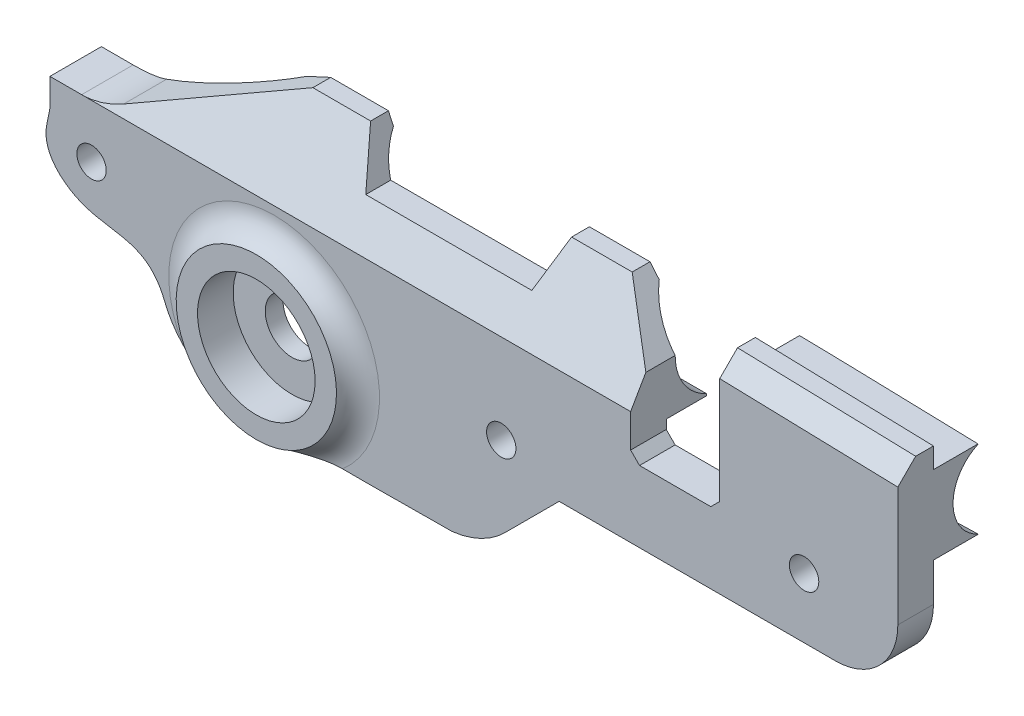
SolidWorks part; units mm, degrees
ref_plane "Спереди" through (0, 0, 0) normal (0, 0, 1) x (1, 0, 0)
ref_plane "Сверху" through (0, 0, 0) normal (0, 1, 0) x (1, 0, 0)
ref_plane "Справа" through (0, 0, 0) normal (1, 0, 0) x (0, 0, -1)
sketch "Эскиз1" plane through (0, 0, 0) normal (0, 0, 1) x (1, 0, 0)
  line L0 (35.5, -9.7) -> (35.5, 0)
  line L1 (35.5, 0) -> (88.5243, 0)
  line L2 (88.5243, 0) -> (88.5243, -5.9869)
  line L3 (59.5019, -24.7) -> (68.4981, -24.6346)
  line L14 (74.4981, -21.7) -> (80.4981, -15.7)
  line L15 (80.4981, -15.7) -> (111.5243, -15.7)
  line L16 (88.5243, -6.7) -> (88.5243, -5.9869)
  line L17 (88.5243, -5.9869) -> (68.4, -5.9869)
  line L18 (68.4, -5.9869) -> (68.4, -14.8)
  line L19 (68.4, -14.8) -> (69.2, -14.8)
  line L20 (69.2, -14.8) -> (69.1981, -17.1867)
  line L21 (69.1981, -17.1867) -> (68.4981, -17.1867)
  line L22 (68.4981, -17.1867) -> (68.4981, -18.1686)
  line L23 (68.4981, -24.3314) -> (68.4981, -24.6346)
  line L26 (74.4981, -21.7) -> (80.4981, -15.7)
  line L27 (80.4981, -15.7) -> (111.5243, -15.7)
  line L28 (88.5243, -6.7) -> (88.5243, -5.9869)
  line L37 (50.5, -9.7) -> (35.5, -9.7)
  line L42 (45.5, -24.7) -> (59.5019, -24.7)
  line L43 (59.5019, -24.7) -> (59.5019, -24.3314)
  line L44 (59.5019, -18.1686) -> (59.5019, -17.1867)
  line L45 (59.5019, -17.1867) -> (58.8019, -17.1867)
  line L46 (58.8019, -17.1867) -> (58.8, -14.8)
  line L47 (58.8, -14.8) -> (59.6, -14.8)
  line L48 (59.6, -14.8) -> (59.6, -10.8637)
  line L49 (59.6, -10.8637) -> (59.4757, -10.8637)
  line L55 (45.5, -24.7) -> (59.5019, -24.7)
  line L130 (118.5243, -8.7) -> (118.5243, -4.7994)
  line L314 (23.328, -6) -> (23.328, -5.8795)
  line L315 (23.328, -6) -> (23.328, -5.8795)
  line L338 (0, 0) -> (152, 0) construction
  line L371 (118.5243, -8.7) -> (118.5243, -4.7994)
  line L421 (97.5243, -7.7) -> (89.5243, -7.7)
  line L422 (97.5243, -7.7) -> (89.5243, -7.7)
  line L423 (89.5243, -7.7) -> (88.5243, -6.7)
  line L424 (89.5243, -7.7) -> (88.5243, -6.7)
  line L425 (118.5243, -4.7994) -> (98.5243, -5.3484)
  line L426 (118.5243, -4.7994) -> (98.5243, -5.3484)
  line L427 (98.5243, -5.3484) -> (98.5243, -6.7)
  line L428 (98.5243, -5.3484) -> (98.5243, -6.7)
  line L429 (98.5243, -6.7) -> (97.5243, -7.7)
  line L430 (98.5243, -6.7) -> (97.5243, -7.7)
  line L464 (31.5, -6.7) -> (31.5, -6)
  line L465 (31.5, -6.7) -> (31.5, -6)
  line L466 (31.5, -6) -> (23.328, -6)
  line L467 (31.5, -6) -> (23.328, -6)
  line L468 (35.5, -9.7) -> (34.5, -9.7)
  line L469 (35.5, -9.7) -> (34.5, -9.7)
  arc A3 (68.4981, -18.1686) -> (68.4981, -24.3314) centre (73.0313, -21.25) ccw
  arc A7 (59.5019, -24.3314) -> (59.5019, -18.1686) centre (54.9687, -21.25) ccw
  arc A53 (111.5243, -15.7) -> (118.5243, -8.7) centre (111.5243, -8.7) ccw
  arc A54 (111.5243, -15.7) -> (118.5243, -8.7) centre (111.5243, -8.7) ccw
  arc A60 (36.2067, -18.3926) -> (45.5, -24.7) centre (45.5, -14.7) ccw
  arc A61 (36.2067, -18.3926) -> (45.5, -24.7) centre (45.5, -14.7) ccw
  arc A70 (68.4981, -24.6346) -> (74.4981, -21.7) centre (67.3567, -14.7) ccw
  arc A71 (68.4981, -24.6346) -> (74.4981, -21.7) centre (67.3567, -14.7) ccw
  arc A72 (31.5, -6.7) -> (34.5, -9.7) centre (34.5, -6.7) ccw
  arc A73 (31.5, -6.7) -> (34.5, -9.7) centre (34.5, -6.7) ccw
  parabola Q1
  spline S1 degree 3 poles (-1530.0279, -1265.6146) (88.0841, 34.5224) (11.9448, -0.836) (45.9487, -32.1139) (86.3243, 81.025) (-456.3325, -1956.6163) knots -1.641607 -1.641607 -1.641607 -1.641607 0.136351 0.447574 3.918539 3.918539 3.918539 3.918539 only from (23.328, -5.8795) to (36.2067, -18.3926)
  spline S2 degree 3 poles (23.328, -5.8795) (23.328, -6.4695) (21.9843, -10.0707) (28.0999, -15.6961) (34.2809, -13.5457) (36.2067, -18.3926) knots 0 0 0 0 0.136351 0.447574 1 1 1 1
  dimension "D1" = 0
  dimension "D2" = 0
extrude "Бобышка-Вытянуть1" add sketch "Эскиз1" along normal blind 4
sketch "Эскиз2" plane through (0, 0, 0) normal (0, 0, -1) x (-1, 0, 0)
  line L1 (-50.5, -9.7) -> (-35.5, -9.7) construction
  line L2 (-50.5, -9.7) -> (-35.5, -9.7) construction
  line L7 (-59.4757, -10.8637) -> (-88.5243, -10.8637) construction
  line L8 (-88.5243, -6.7) -> (-88.5243, 0) construction
  line L9 (-88.5243, -10.8637) -> (-88.5243, 0) construction
  line L10 (-88.5243, 0) -> (-35.5, 0)
  line L12 (-35.5, 0) -> (-35.5, -9.7) construction
  line L13 (-59.5237, -10.5637) -> (-88.5243, -10.5637) construction
  line L14 (-50.4912, -9.4) -> (-35.5, -9.4)
  line L15 (-35.5, -9.4) -> (-35.5, 0)
  line L16 (-88.5243, -10.5637) -> (-88.5243, 0) construction
  line L17 (-59.5237, -10.5637) -> (-64, -10.5637)
  line L18 (-64, -10.5637) -> (-64, 0) construction
  line L19 (-64, -10.5637) -> (-64, -5.6869)
  line L20 (-64, -5.6869) -> (-88.5243, -5.6869)
  line L21 (-88.5243, -5.9869) -> (-68.4, -5.9869) construction
  line L22 (-88.5243, -5.6869) -> (-88.5243, 0)
  parabola Q4 construction
  parabola Q5 construction
  spline S0 degree 1 poles (-59.5237, -10.5637) (-50.4912, -9.4) knots 0 0 1 1 construction
  spline S1 degree 3 poles (-59.5237, -10.5637) (-58.798, -10.3262) (-57.3196, -9.9169) (-55.0793, -9.5203) (-52.8072, -9.3355) (-51.2592, -9.3553) (-50.4912, -9.4) knots 0.499721 0.499721 0.499721 0.499721 0.499884 0.500048 0.500211 0.500374 0.500374 0.500374 0.500374
  dimension "D2" = 0.3
  dimension "D1" = 0.3
extrude "Бобышка-Вытянуть2" add sketch "Эскиз2" along normal blind 3
sketch "Эскиз3" plane through (35.5, 0, 0) normal (-1, 0, 0) x (0, 0, 1)
  line L0 (-3, -9.4) -> (-4.8006, -9.4)
  line L1 (-3, -9.4) -> (-3, -6.5)
  line L2 (-3, -9.4) -> (-3, 0) construction
  line L3 (-3.25, -6.5) -> (-6.25, -6.5) construction
  arc A0 (-4.8006, -9.4) -> (-3, -6.5) centre (-6.1307, -6.5651) ccw
extrude "Бобышка-Вытянуть3" add sketch "Эскиз3" against normal blind 17 contours A0 L0 L1
sketch "Эскиз4" plane through (35.5, 0, 0) normal (-1, 0, 0) x (0, 0, 1)
  circle A0 centre (-7, 0) radius 6
  dimension "D1" = 12
extrude "Вырез-Вытянуть1" cut sketch "Эскиз4" against normal blind 57
sketch "Эскиз5" plane through (0, 0, 0) normal (0, 0, -1) x (-1, 0, 0)
  line L0 (-60, -24.6383) -> (-68, -24.6383)
  line L2 (-60, -24.6383) -> (-60, -5.6869)
  line L3 (-60, -5.6869) -> (-68, -5.6869)
  line L4 (-68, -24.6383) -> (-68, -5.6869)
  line L5 (-59.75, -25.5) -> (-59.75, -24.5) construction
  line L6 (-59.5019, -24.7) -> (-68.4981, -24.6346) construction
  line L7 (-88.5243, -5.6869) -> (-64, -5.6869) construction
  dimension "D1" = 8
  dimension "D2" = 0.25
extrude "Бобышка-Вытянуть4" add sketch "Эскиз5" along normal blind 5.5
sketch "Эскиз6" plane through (0, 0, -7) normal (0, 0, -1) x (-1, 0, 0)
  line L0 (-64, -25.6536) -> (-64, 0) construction
  line L2 (-68.4981, -24.6346) -> (-68.4981, -24.3314) construction
  line L3 (-68.4981, -18.1686) -> (-68.4981, -17.1867) construction
  line L4 (-69.1981, -17.1867) -> (-68.4981, -17.1867) construction
  line L5 (-69.1981, -17.1867) -> (-69.2, -14.8) construction
  line L6 (-68.4, -14.8) -> (-69.2, -14.8) construction
  line L7 (-68.4, -14.8) -> (-68.4, -5.9869) construction
  line L8 (-68.4981, -25.6536) -> (-68.4981, -24.3314)
  line L9 (-68.4981, -18.1686) -> (-68.4981, -17.1867)
  line L10 (-69.1981, -17.1867) -> (-68.4981, -17.1867)
  line L11 (-69.1981, -17.1867) -> (-69.2, -14.8)
  line L12 (-68.4, -14.8) -> (-69.2, -14.8)
  line L13 (-68.4, -14.8) -> (-68.4, -5.6869)
  line L14 (-68.4, -5.6869) -> (-64, -5.6869)
  line L15 (-68.4981, -25.6536) -> (-64, -25.6536)
  line L16 (-64, -25.6536) -> (-64, -5.6869)
  line L17 (-88.5243, -5.6869) -> (-68, -5.6869) construction
  arc A0 (-68.4981, -24.3314) -> (-68.4981, -18.1686) centre (-73.0313, -21.25) ccw construction
  arc A1 (-68.4981, -24.3314) -> (-68.4981, -18.1686) centre (-73.0313, -21.25) ccw
revolve "Вырез-Повернуть1" cut sketch "Эскиз6" angle 360 about L0
sweep "По траектории4" add
sweep "По траектории5" add
sketch "Эскиз8" plane through (88.5243, 0, 0) normal (1, 0, 0) x (0, 0, -1)
  line L0 (3, -5.6869) -> (5.0871, -5.6869)
  line L1 (5.167, -5.6869) -> (3, -5.6869) construction
  line L2 (3, -5.6869) -> (3, -4.4721)
  arc A0 (5.0871, -5.6869) -> (3, -4.4721) centre (7, 0) cw
  arc A4 (1, 0) -> (3, -4.4721) centre (7, 0) ccw construction
extrude "Бобышка-Вытянуть7" add sketch "Эскиз8" against normal blind 23
sketch "Эскиз9" plane through (0, -24.7, 0) normal (0, -1, 0) x (1, 0, 0)
  line L0 (45.5, 0) -> (59.5019, 0) construction
  line L1 (90.8392, -5.5) -> (12.5227, -5.5)
  line L2 (90.8392, -5.5) -> (90.8392, -4.5)
  line L3 (90.8392, -4.5) -> (12.5227, -4.5)
  line L4 (12.5227, -5.5) -> (12.5227, -4.5)
  dimension "D1" = 1
  dimension "D2" = 4.5
sketch "Эскиз10" plane through (0, 0, -5.5) normal (0, 0, -1) x (-1, 0, 0)
  line L3 (-64, -18.1686) -> (-64, -24.3314) construction
  line L4 (-68, -18.1686) -> (-60, -18.1686) construction
  line L9 (-67.7439, -18.3746) -> (-68.1664, -17.6823)
  line L10 (-68.1664, -17.6823) -> (-68.1664, -24.8177)
  line L12 (-68.1664, -21.25) -> (-68, -21.25) construction
  line L13 (-68, -18.5309) -> (-68, -23.9691) construction
  line L14 (-68.1664, -24.8177) -> (-67.7439, -24.1254)
  line L15 (-59.8336, -21.25) -> (-60, -21.25) construction
  line L16 (-59.8336, -24.8177) -> (-60.2561, -24.1254)
  line L17 (-59.8336, -17.6823) -> (-59.8336, -24.8177)
  line L18 (-60.2561, -18.3746) -> (-59.8336, -17.6823)
  line L19 (-68, -24.3314) -> (-60, -24.3314) construction
  spline S0 degree 3 poles (-60.2561, -24.1254) (-60.3867, -23.9114) (-60.5049, -23.6868) (-60.7106, -23.2237) (-60.7972, -22.9874) (-60.9374, -22.5059) (-60.9911, -22.2608) (-61.0638, -21.7598) (-61.0825, -21.5031) (-61.0825, -20.7433) (-61.0098, -20.2429) (-60.725, -19.2649) (-60.5188, -18.8052) (-60.2561, -18.3746) knots 0 0 0 0 0.125 0.125 0.25 0.25 0.375 0.375 0.5 0.5 0.75 0.75 1 1 1 1
  spline S7 degree 3 poles (1613.8983, 2457.5099) (-204.3865, -9.7564) (-76.4301, -43.8096) (-67.2894, -23.2237) (-67.2028, -22.9874) (-67.0626, -22.5059) (-67.0089, -22.2608) (-66.9362, -21.7598) (-66.9175, -21.5031) (-66.9175, -20.7433) (-66.9902, -20.2429) (-79.1546, 21.5361) (-546.0783, -146.5592) (2910.5363, -344.1123) knots -10.861263 -10.861263 -10.861263 -10.861263 0.125 0.125 0.25 0.25 0.375 0.375 0.5 0.5 0.75 0.75 21.857707 21.857707 21.857707 21.857707 only from (-67.7439, -24.1254) to (-67.7439, -18.3746)
  spline S8 degree 3 poles (-67.7439, -24.1254) (-67.6133, -23.9114) (-67.4951, -23.6868) (-67.2894, -23.2237) (-67.2028, -22.9874) (-67.0626, -22.5059) (-67.0089, -22.2608) (-66.9362, -21.7598) (-66.9175, -21.5031) (-66.9175, -20.7433) (-66.9902, -20.2429) (-67.275, -19.2649) (-67.4812, -18.8052) (-67.7439, -18.3746) knots 0 0 0 0 0.125 0.125 0.25 0.25 0.375 0.375 0.5 0.5 0.75 0.75 1 1 1 1
  dimension "D1" = 0.3
extrude "Вырез-Вытянуть4" cut sketch "Эскиз10" against normal up to surface (5.5 mm away)
extrude "Вырез-Вытянуть5" cut sketch "Эскиз9" against normal through all
sketch "Эскиз11" plane through (0, -14.8, 0) normal (0, -1, 0) x (1, 0, 0)
  line L0 (67.6208, -4.5) -> (60.3792, -4.5)
  arc A0 (67.6208, -4.5) -> (60.3792, -4.5) centre (64, -7) ccw construction
  arc A1 (67.6208, -4.5) -> (60.3792, -4.5) centre (64, -7) ccw
extrude "Вырез-Вытянуть6" cut sketch "Эскиз11" against normal through all
sketch "Эскиз12" plane through (0, 0, -4.5) normal (0, 0, -1) x (-1, 0, 0)
  line L1 (-59.5129, -10.5991) -> (-62.167, -10.5991)
  line L2 (-59.5129, -10.5991) -> (-59.5129, -4.4721)
  line L3 (-59.5129, -4.4721) -> (-62.167, -4.4721)
  line L4 (-62.167, -10.5991) -> (-62.167, -4.4721)
extrude "Вырез-Вытянуть7" cut sketch "Эскиз12" against normal up to surface (1.5 mm away)
sketch "Эскиз13" plane through (0, 0, 4) normal (0, 0, 1) x (1, 0, 0)
  line L1 (90, 5.7) -> (22, 5.7) construction
  line L2 (47.8503, 5.7) -> (54.3321, 5.7)
  line L3 (54.3321, 5.7) -> (56.5049, 0.992)
  line L4 (56.5049, 0.992) -> (75.151, 0.992)
  line L5 (75.151, 0.992) -> (76.8954, 5.7)
  line L6 (76.8954, 5.7) -> (83.6988, 5.7)
  line L7 (83.6988, 5.7) -> (88.5243, 0)
  line L8 (88.5243, 0) -> (35.5, 0) construction
  line L12 (47.8503, 5.7) -> (29.086, -2.9603)
  line L13 (29.086, -2.9603) -> (88.5243, -2.9603)
  line L14 (88.5243, -6.7) -> (88.5243, 0) construction
  line L15 (26.8897, -2.9603) -> (88.5243, -2.9603) construction
  line L16 (88.5243, -2.9603) -> (88.5243, 0)
extrude "Бобышка-Вытянуть8" add sketch "Эскиз13" against normal blind 7
sketch "Эскиз15" plane through (88.5243, 0, 0) normal (1, 0, 0) x (0, 0, -1)
  circle A0 centre (7, 0) radius 6
extrude "Вырез-Вытянуть8" cut sketch "Эскиз15" against normal blind 57
chamfer "Фаска1" distance 5 angle 60 1 edges at (51.0912, 5.7, 4)
sketch "Эскиз16" plane through (0, 0, 4) normal (0, 0, 1) x (1, 0, 0)
  circle A0 centre (48.5, -15.7) radius 6.6
  circle A1 centre (48.5, -15.7) radius 6.6 construction
extrude "Вырез-Вытянуть9" cut sketch "Эскиз16" against normal blind 2
sketch "Эскиз17" plane through (0, 0, 2) normal (0, 0, 1) x (1, 0, 0)
  circle A0 centre (48.5, -15.7) radius 3
  dimension "D1" = 6
extrude "Вырез-Вытянуть10" cut sketch "Эскиз17" against normal blind 4
sketch "Эскиз18" plane through (0, 0, 4) normal (0, 0, 1) x (1, 0, 0)
  circle A0 centre (48.5, -15.7) radius 9
  circle A1 centre (48.5, -15.7) radius 6.6 construction
  circle A2 centre (48.5, -15.7) radius 6.6
  dimension "D1" = 2.4
extrude "Бобышка-Вытянуть9" add sketch "Эскиз18" along normal blind 2
fillet "Скругление1" radius 3 1 edges at (57.5, -15.7, 4)
sketch "Эскиз20" plane through (0, 0, 4) normal (0, 0, 1) x (1, 0, 0)
  line L2 (31.5, -6.7) -> (31.5, -6) construction
  line L3 (35.5, -9.7) -> (34.5, -9.7) construction
  line L4 (35.5, -9.7) -> (34.5, -9.7)
  line L5 (31.5, -6.7) -> (31.5, -6)
  line L6 (35.5, -9.7) -> (35.5, -2.9603)
  line L7 (35.5, -2.9603) -> (23.328, -2.9603)
  line L9 (31.5, -6) -> (23.328, -6) construction
  line L10 (31.5, -6) -> (23.328, -6)
  line L11 (23.328, -6) -> (23.328, -2.9603)
  arc A0 (31.5, -6.7) -> (34.5, -9.7) centre (34.5, -6.7) ccw construction
  arc A1 (31.5, -6.7) -> (34.5, -9.7) centre (34.5, -6.7) ccw
extrude "Бобышка-Вытянуть10" add sketch "Эскиз20" against normal blind 7
sketch "Эскиз21" plane through (0, 0, -3) normal (0, 0, -1) x (-1, 0, 0)
  line L3 (-31.5, -5.8) -> (-31.7, -5.8)
  line L4 (-31.7, -6.7) -> (-31.7, -6)
  line L5 (-35.5, -9.5) -> (-34.5, -9.5)
  line L6 (-31.7, -6.7) -> (-31.7, -6)
  line L7 (-35.5, -9.5) -> (-34.5, -9.5)
  line L8 (-23.328, -5.8) -> (-31.5, -5.8)
  line L9 (-23.328, -5.8) -> (-31.5, -5.8)
  line L10 (-31.7, -5.8) -> (-31.7, -6)
  line L11 (-35.5, -9.5) -> (-35.5, -10.6816)
  line L12 (-35.5, -10.6816) -> (-23.328, -10.6816)
  line L13 (-23.328, -10.6816) -> (-23.328, -5.8)
  arc A2 (-34.5, -9.5) -> (-31.7, -6.7) centre (-34.5, -6.7) ccw
  arc A3 (-34.5, -9.5) -> (-31.7, -6.7) centre (-34.5, -6.7) ccw
  dimension "D1" = 0.2
  dimension "D2" = 0.2
extrude "Вырез-Вытянуть11" cut sketch "Эскиз21" against normal up to surface (3 mm away)
sketch "Эскиз22" plane through (23.328, 0, 0) normal (-1, 0, 0) x (0, 0, 1)
  circle A0 centre (-7, 0) radius 6
  dimension "D1" = 12
extrude "Вырез-Вытянуть12" cut sketch "Эскиз22" against normal blind 20
fillet "Скругление2" radius 10 1 edges at (29.086, -2.9603, 1.1094)
sketch "Эскиз24" plane through (0, 0, 4) normal (0, 0, 1) x (1, 0, 0)
  line L8 (118.5243, -4.7994) -> (98.5243, -5.3484)
  line L9 (98.5243, 14.0131) -> (118.5243, 14.0131)
  line L10 (98.5243, 14.0131) -> (98.5243, -5.3484)
  line L11 (118.5243, 14.0131) -> (118.5243, -4.7994)
extrude "Бобышка-Вытянуть11" add sketch "Эскиз24" against normal up to surface (4 mm away)
sketch "Эскиз25" plane through (0, 0, 0) normal (0, 0, -1) x (-1, 0, 0)
  line L10 (-98.5243, 4.9482) -> (-118.5243, 4.3992)
  line L11 (-98.5243, 14.0131) -> (-98.5243, -6.7) construction
  line L13 (-118.5243, 4.3992) -> (-118.5243, -4.3992)
  line L14 (-118.5243, -8.7) -> (-118.5243, 14.0131) construction
  line L15 (-118.5243, -4.3992) -> (-98.5243, -4.9482)
  line L16 (-98.5243, -4.9482) -> (-98.5243, 4.9482)
  line L17 (-144, 4) -> (-93, 5.4) construction
  line L18 (-144, -4) -> (-93, -5.4) construction
  dimension "D1" = 0.3
  dimension "D2" = 0.3
extrude "Бобышка-Вытянуть12" add sketch "Эскиз25" along normal blind 5
sketch "Эскиз26" plane through (0, 0, -7) normal (0, 0, -1) x (-1, 0, 0)
  line L1 (-98.5243, 5.3484) -> (-118.5243, 4.7994)
  line L2 (-98.5243, 5.3484) -> (-98.5243, 0)
  line L3 (0, 0) -> (-152, 0) construction
  line L4 (-98.5243, 0) -> (-118.5243, 0)
  line L6 (-118.5243, 0) -> (-118.5243, 4.7994)
  line L7 (-118.5243, 0) -> (-127.4574, 0) construction
revolve "Вырез-Повернуть2" cut sketch "Эскиз26" angle 360 about L7
chamfer "Фаска2" distance 6 angle 30 1 edges at (98.5243, 14.0131, 2)
chamfer "Фаска3" distance 4 angle 60 1 edges at (118.5243, 14.0131, 2)
sketch "Эскиз27" plane through (0, 0, 0) normal (0, 0, 1) x (1, 0, 0)
  line L0 (118.5243, -4.7994) -> (118.5243, -15.7) construction
  line L1 (80.4981, -15.7) -> (118.5243, -15.7) construction
  line L4 (98.5243, -6.7) -> (97.5243, -7.7) construction
  line L5 (98.5243, -5.3484) -> (98.5243, -6.7) construction
  line L7 (118.5243, -4.7994) -> (118.5243, -15.7)
  line L8 (88.5243, -15.7) -> (118.5243, -15.7)
  line L9 (89.5243, -7.7) -> (88.5243, -6.7)
  line L10 (97.5243, -7.7) -> (89.5243, -7.7)
  line L11 (98.5243, -6.7) -> (97.5243, -7.7)
  line L12 (98.5243, -5.3484) -> (98.5243, -6.7)
  line L13 (98.5243, -5.3484) -> (118.5243, -4.7994)
  line L14 (88.5243, -6.7) -> (88.5243, -15.7)
extrude "Бобышка-Вытянуть13" add sketch "Эскиз27" along normal up to surface (4 mm away)
extrude "Вырез-Вытянуть13" cut sketch "Эскиз28" against normal through all
sketch "Эскиз28" plane through (0, 0, 4) normal (0, 0, 1) x (1, 0, 0)
  line L0 (28, -8.9603) -> (28, -2.9603) construction
  line L2 (28, -8.9603) -> (108, -8.9603) construction
  line L4 (108, -8.9603) -> (108, -15.7) construction
  circle A0 centre (28, -8.9603) radius 1.65
  circle A1 centre (74, -13) radius 1.65
  circle A2 centre (108, -8.9603) radius 1.65
fillet "Скругление4" radius 7 1 edges at (118.5243, -15.7, 2)
extrude "Вырез-Вытянуть14" cut sketch "Эскиз29" against normal through all
sketch "Эскиз29" plane through (0, 0, -18) normal (0, 0, -1) x (-1, 0, 0)
  line L0 (-120.6941, 6.6405) -> (-95.8294, 7.3231)
  line L1 (-95.8294, 7.3231) -> (-95.8294, 18.3597)
  line L2 (-95.8294, 18.3597) -> (-120.6941, 18.3597)
  line L3 (-120.6941, 18.3597) -> (-120.6941, 6.6405)
chamfer "Фаска4" distance 2 angle 45 1 edges at (108.5243, 6.9746, 4)
